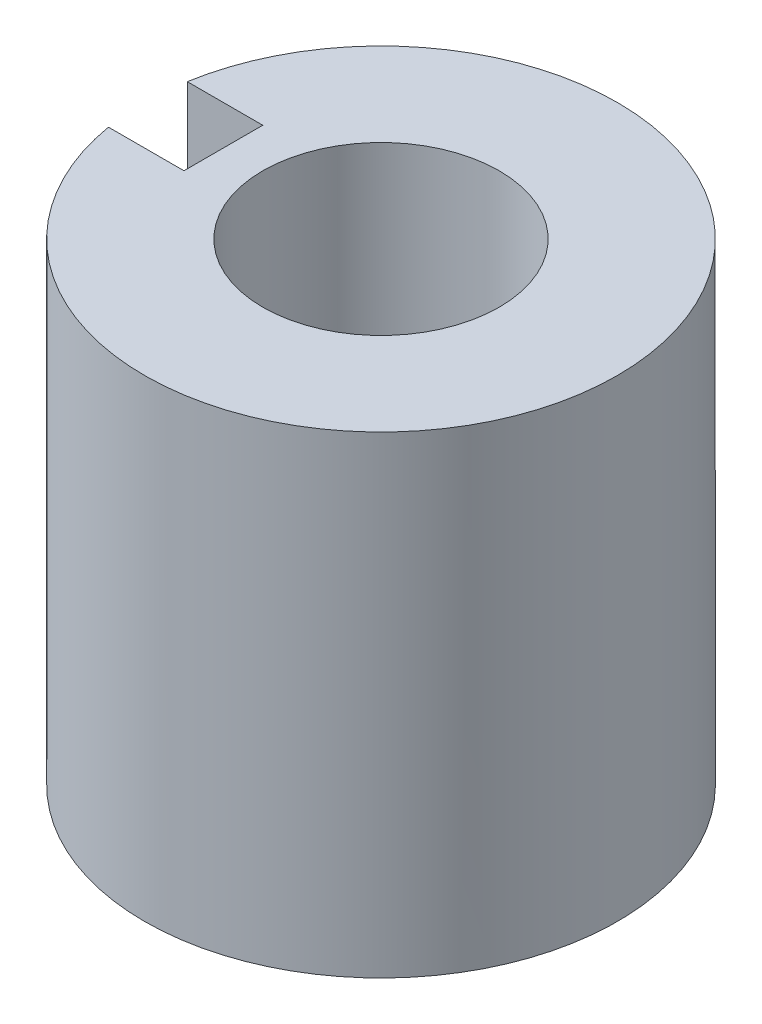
SolidWorks part; units mm, degrees
ref_plane "Front Plane" through (0, 0, 0) normal (0, 0, 1) x (1, 0, 0)
ref_plane "Top Plane" through (0, 0, 0) normal (0, 1, 0) x (1, 0, 0)
ref_plane "Right Plane" through (0, 0, 0) normal (1, 0, 0) x (0, 0, -1)
sketch "Sketch1" plane through (0, 0, 0) normal (0, 1, 0) x (1, 0, 0)
  circle A0 centre (3, 0) radius 3
  circle A1 centre (3, 0) radius 1
  dimension "D1" = 6
  dimension "D2" = 2
extrude "Boss-Extrude1" add sketch "Sketch1" along normal blind 6
sketch "Sketch2" plane through (0, 0, 0) normal (1, 0, 0) x (0, 0, -1)
  line L0 (0, 0) -> (0, 0.75)
  line L1 (0, 0.75) -> (0, 1.5)
  line L2 (0, 1.5) -> (0, 3)
  line L3 (0, 3) -> (0, 6)
  line L4 (0, 6) -> (0, 12)
  dimension "D1" = 0.75
  dimension "D2" = 0.75
  dimension "D3" = 1.5
  dimension "D4" = 3
  dimension "D5" = 6
sketch "Sketch3" plane through (0, 0, 0) normal (1, 0, 0) x (0, 0, -1)
  line L0 (0, 1.5) -> (0, 3) construction
  line L1 (-0.5, 1.5) -> (0.5, 1.5)
  line L2 (-0.5, 1.5) -> (-0.5, 6)
  line L3 (-0.5, 6) -> (0.5, 6)
  line L4 (0.5, 1.5) -> (0.5, 6)
  line L5 (-0.5, 1.5) -> (0.5, 6) construction
  line L6 (-0.5, 6) -> (0.5, 1.5) construction
  point P0 (0, 3.75)
  dimension "D1" = 1
  dimension "D2" = 4.5
extrude "Cut-Extrude2" cut sketch "Sketch3" along normal blind 1
sketch "Sketch4" plane through (0, 6, 0) normal (0, 1, 0) x (1, 0, 0)
  circle A0 centre (3, 0) radius 1.5
  circle A1 centre (3, 0) radius 1 construction
  dimension "D1" = 0.5
extrude "Cut-Extrude4" cut sketch "Sketch4" against normal up to surface (6 mm away) contours A0
